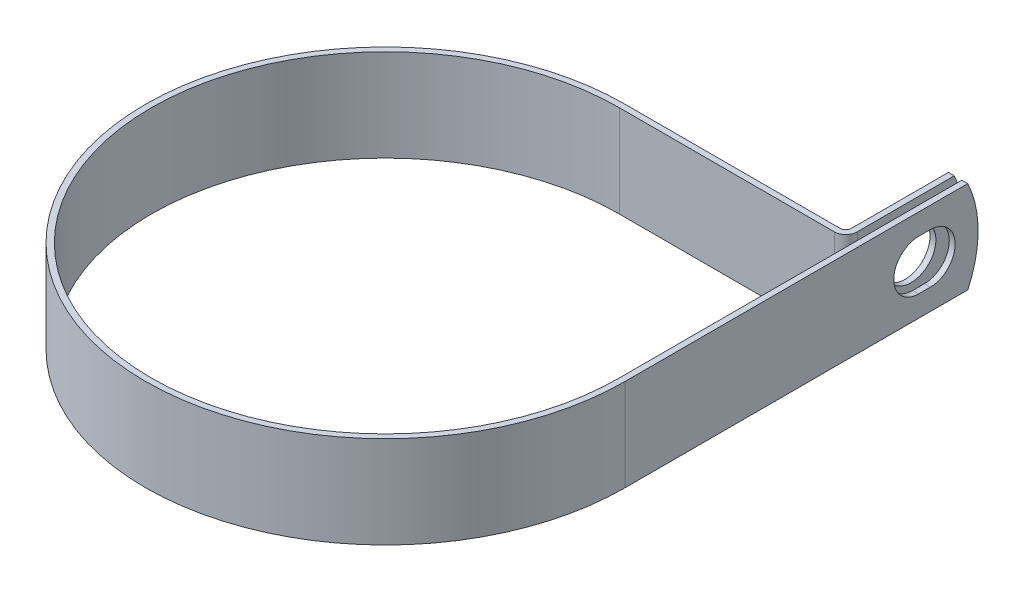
SolidWorks part; units mm, degrees
ref_plane "Front Plane" through (0, 0, 0) normal (0, 0, 1) x (1, 0, 0)
ref_plane "Top Plane" through (0, 0, 0) normal (0, 1, 0) x (1, 0, 0)
ref_plane "Right Plane" through (0, 0, 0) normal (1, 0, 0) x (0, 0, -1)
sketch "Sketch1" plane through (0, 0, 0) normal (0, 1, 0) x (1, 0, 0)
  line L0 (0, 48.4124) -> (44.4602, 48.4124)
  line L1 (48.4124, 0) -> (48.4124, 48.4124)
  line L2 (46.8376, 72.9996) -> (46.8376, 50.7898)
  line L5 (48.4124, 48.4124) -> (48.4124, 72.9996)
  arc A0 (0, 48.4124) -> (48.4124, 0) centre (0, 0) ccw
  arc A3 (44.4602, 48.4124) -> (46.8376, 50.7898) centre (44.4602, 50.7898) ccw
extrude "Extrude-Thin1" add sketch "Sketch1" along normal mid plane 19.05 thin
sketch "Sketch2" plane through (45.6184, 0, 0) normal (-1, 0, 0) x (0, 0, 1)
  line L0 (-72.9996, 9.525) -> (-72.9996, -9.525) construction
  line L7 (0, 9.525) -> (0, -9.525) construction
  circle A0 centre (-61.8998, 0) radius 5.1562
  point P2 (-72.9996, 0)
extrude "Cut-Extrude1" cut sketch "Sketch2" against normal up to surface (1.2192 mm away)
sketch "Sketch3" plane through (49.6316, 0, 0) normal (1, 0, 0) x (0, 0, -1)
  line L0 (60.706, 0) -> (63.0936, 0) construction
  line L1 (60.706, 5.1562) -> (63.0936, 5.1562)
  line L2 (60.706, -5.1562) -> (63.0936, -5.1562)
  line L3 (72.9996, 9.525) -> (72.9996, -9.525) construction
  arc A0 (60.706, 5.1562) -> (60.706, -5.1562) centre (60.706, 0) ccw
  arc A1 (63.0936, -5.1562) -> (63.0936, 5.1562) centre (63.0936, 0) ccw
  point P3 (61.8998, 0)
  point P8 (72.9996, 0)
  point P11 (55.5498, 0)
  point P12 (68.2498, 0)
extrude "Cut-Extrude2" cut sketch "Sketch3" against normal up to surface (1.2192 mm away)
sketch "Sketch4" plane through (45.6184, 0, 0) normal (-1, 0, 0) x (0, 0, 1)
  line L0 (-72.9996, 9.525) -> (-72.9996, -9.525)
  line L1 (-72.9996, 9.525) -> (-70.8551, 9.525)
  line L2 (-72.9996, 9.525) -> (-50.7898, 9.525) construction
  line L3 (-72.9996, -9.525) -> (-70.8551, -9.525)
  line L4 (-72.9996, -9.525) -> (-50.7898, -9.525) construction
  arc A0 (-70.8551, 9.525) -> (-70.8551, -9.525) centre (-50.7746, 0) ccw
extrude "Cut-Extrude3" cut sketch "Sketch4" against normal through all contours A0 M4 M5 | A0 L0 M2
equation "\"D1@Sketch3\" = \"D2@Sketch2\""
equation "\"D7@Sketch1\" = \"D3@Sketch2\" + \"D1@Sketch3\""
equation "\"D1@Sketch4\" = ( \"D1@Extrude-Thin1\" + .125 ) * 2"
equation "\"D2@Sketch1\"=1.95*\"D5@Extrude-Thin1\""
equation "\"D2@Sketch3\" = \"D1@Sketch2\""
